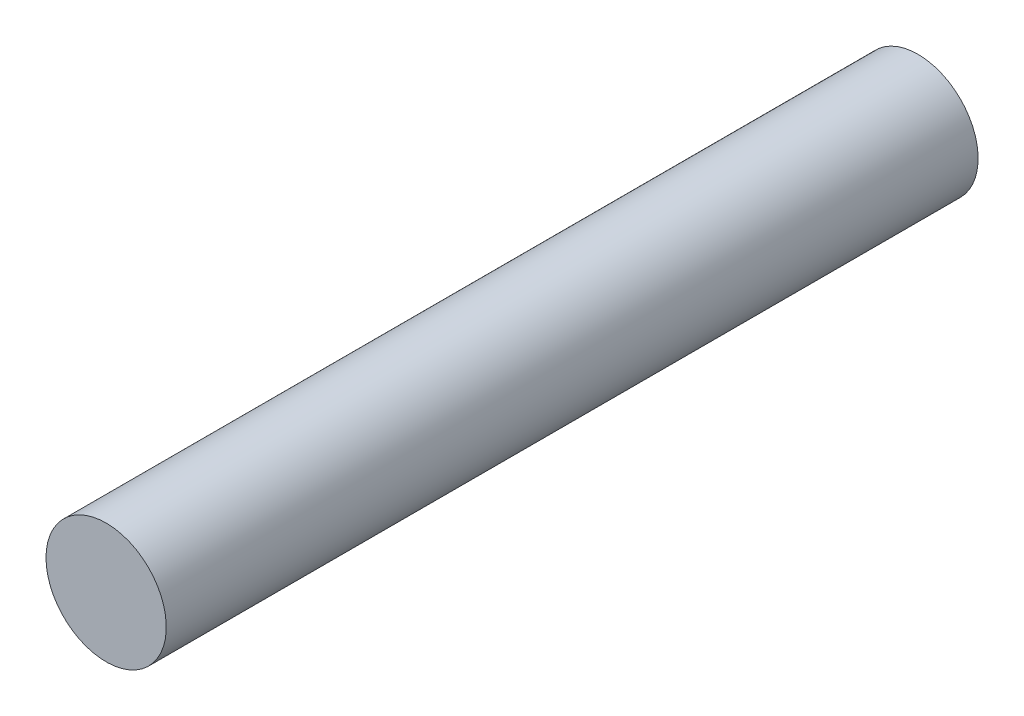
SolidWorks part; units mm, degrees
ref_plane "Face" through (0, 0, 0) normal (0, 0, 1) x (1, 0, 0)
ref_plane "Dessus" through (0, 0, 0) normal (0, 1, 0) x (1, 0, 0)
ref_plane "Droite" through (0, 0, 0) normal (1, 0, 0) x (0, 0, -1)
sketch "Esquisse1" plane through (0, 0, 0) normal (0, 0, 1) x (1, 0, 0)
  circle A0 centre (0, 0) radius 1
  dimension "D1" = 2
extrude "Cylindre de base" add sketch "Esquisse1" along normal mid plane 13.5
